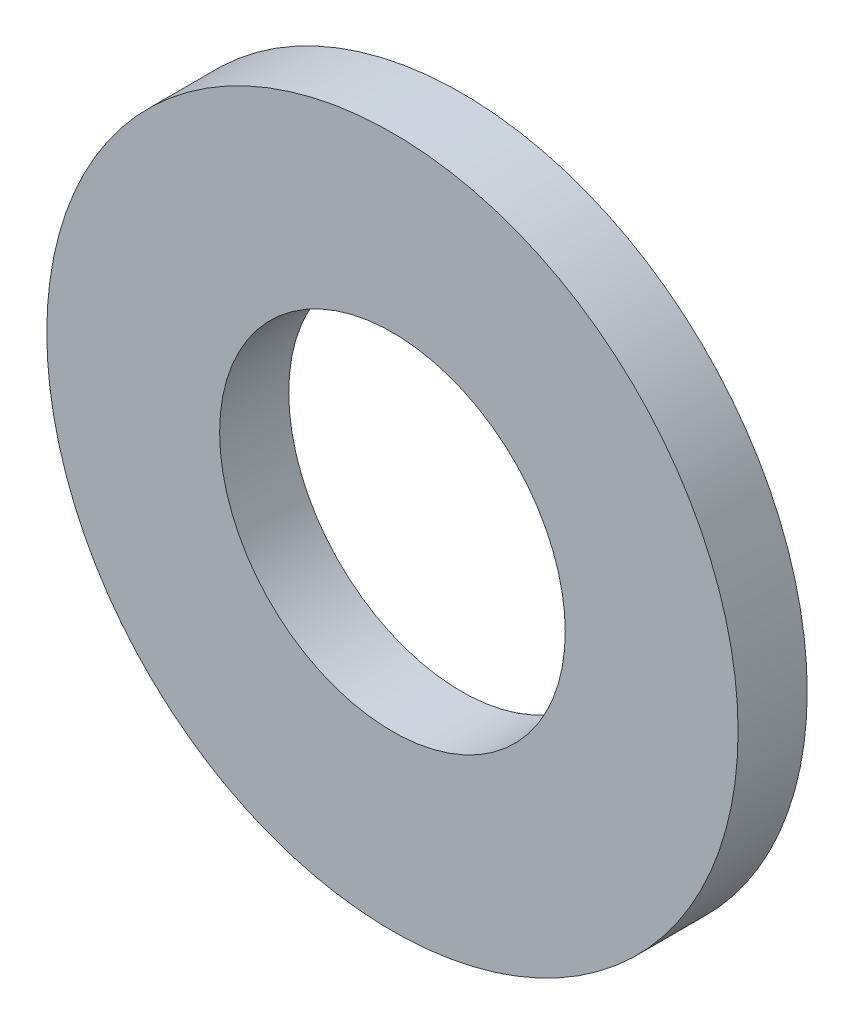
SolidWorks part; units mm, degrees
ref_plane "Plan de face" through (0, 0, 0) normal (0, 0, 1) x (1, 0, 0)
ref_plane "Plan de dessus" through (0, 0, 0) normal (0, 1, 0) x (1, 0, 0)
ref_plane "Plan de droite" through (0, 0, 0) normal (1, 0, 0) x (0, 0, -1)
sketch "Esquisse1" plane through (0, 0, 0) normal (0, 0, 1) x (1, 0, 0)
  circle A0 centre (0, 0) radius 6.25
  circle A1 centre (0, 0) radius 12.5
  dimension "D1" = 12.5
  dimension "D2" = 25
extrude "Extrusion1" add sketch "Esquisse1" along normal blind 2.5
